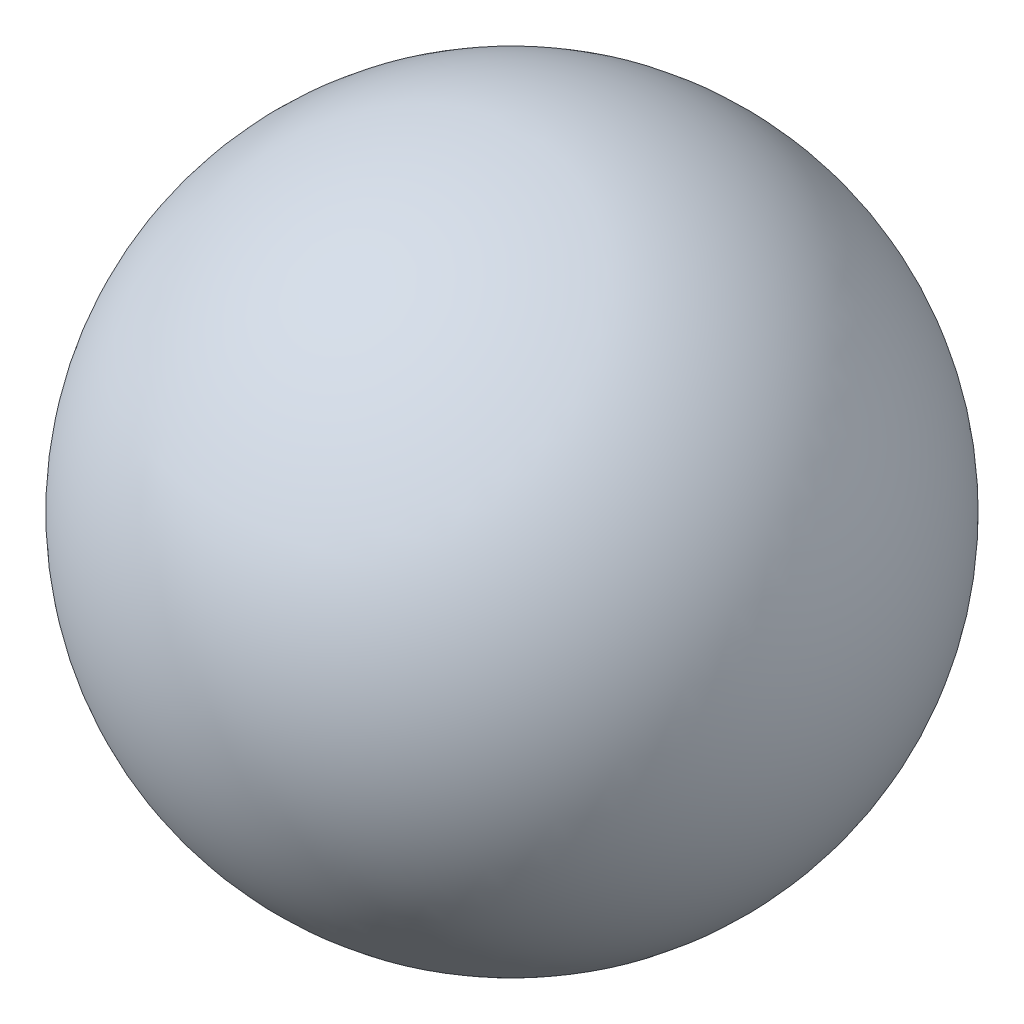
SolidWorks part; units mm, degrees
ref_plane "前视基准面" through (0, 0, 0) normal (0, 0, 1) x (1, 0, 0)
ref_plane "上视基准面" through (0, 0, 0) normal (0, 1, 0) x (1, 0, 0)
ref_plane "右视基准面" through (0, 0, 0) normal (1, 0, 0) x (0, 0, -1)
sketch "草图1" plane through (0, 0, 0) normal (0, 0, 1) x (1, 0, 0)
  line L0 (0, -6.6479) -> (0, 6.6479) construction
  line L1 (0, -3) -> (0, 3)
  arc A0 (0, 3) -> (0, -3) centre (0, 0) ccw
  arc A1 (0, -3) -> (0, 3) centre (0, 0) ccw construction
  point P5 (0, 0)
  dimension "D1" = 3
revolve "旋转1" add sketch "草图1" angle 360 about L0
